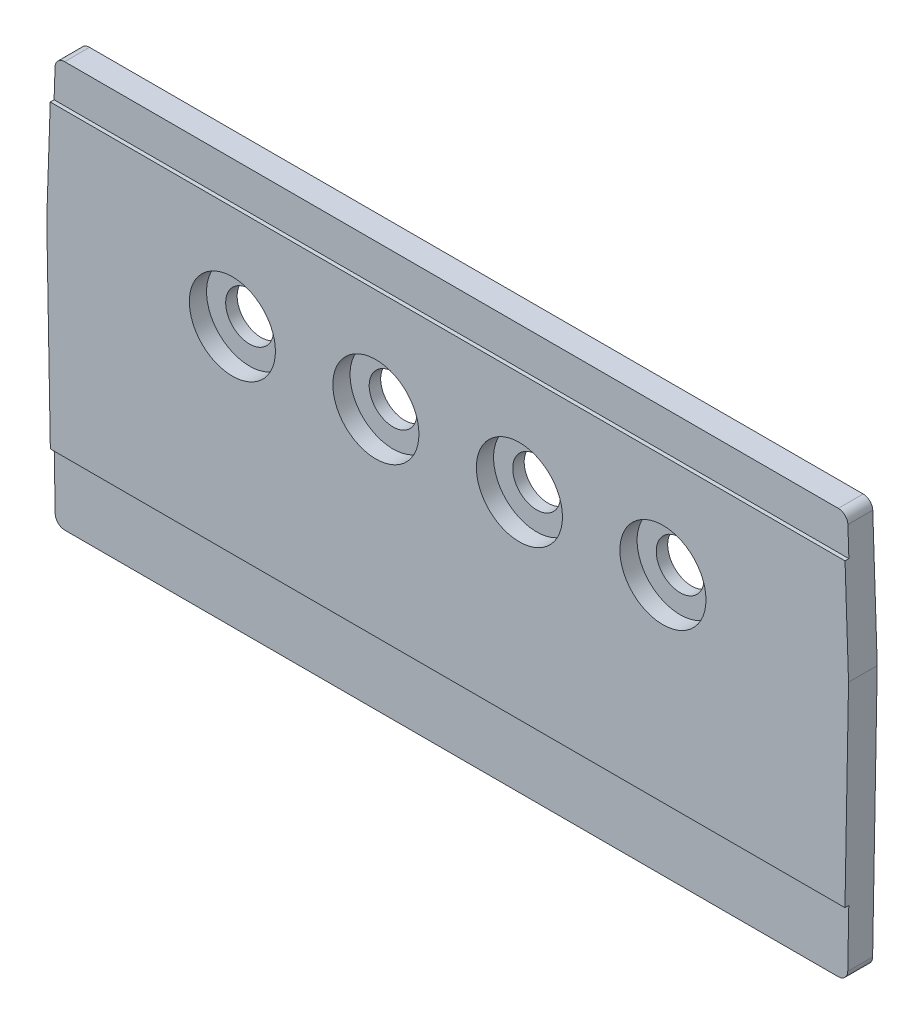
SolidWorks part; units mm, degrees
ref_plane "Plan de face" through (0, 0, 0) normal (0, 0, 1) x (1, 0, 0)
ref_plane "Plan de dessus" through (0, 0, 0) normal (0, 1, 0) x (1, 0, 0)
ref_plane "Plan de droite" through (0, 0, 0) normal (1, 0, 0) x (0, 0, -1)
sketch "Esquisse1" plane through (0, 0, 0) normal (0, 0, 1) x (1, 0, 0)
  line L0 (0, -14.2402) -> (0, 52.3672) construction
  line L1 (-7.052, 0) -> (132.3643, 0) construction
  line L2 (121.7066, 27.6) -> (-7.052, 27.6) construction
  line L3 (1.482, 0) -> (82.318, 0)
  line L4 (83.3326, 41.4338) -> (83.8, 27.6)
  line L5 (1.4668, 42.4) -> (82.3332, 42.4)
  line L6 (83.8, 27.6) -> (83.3178, 0.9819)
  line L7 (19.4, 52.3672) -> (19.4, 19.2584) construction
  line L8 (80.4261, 24.5) -> (96.6476, 24.5) construction
  line L9 (83.8, -14.2402) -> (83.8, 52.3672) construction
  line L10 (132.3643, 42.4) -> (-7.052, 42.4) construction
  line L11 (41.9, -2.3598) -> (41.9, 9.227) construction
  line L12 (83.3, 46.3047) -> (83.3, -2.9391) construction
  line L13 (0, 27.6) -> (0.4822, 0.9819)
  line L14 (0.4674, 41.4338) -> (0, 27.6)
  circle A0 centre (19.4, 27.6) radius 2.5
  circle A1 centre (34.4, 27.6) radius 2.5
  circle A2 centre (49.4, 27.6) radius 2.5
  circle A3 centre (64.4, 27.6) radius 2.5
  arc A4 (83.3178, 0.9819) -> (82.318, 0) centre (82.318, 1) cw
  arc A5 (83.3326, 41.4338) -> (82.3332, 42.4) centre (82.3332, 41.4) ccw
  arc A6 (0.4822, 0.9819) -> (1.482, 0) centre (1.482, 1) ccw
  arc A7 (0.4674, 41.4338) -> (1.4668, 42.4) centre (1.4668, 41.4) cw
  circle A8 centre (124.4, 27.6) radius 2.5
  circle A9 centre (109.4, 27.6) radius 2.5
  circle A10 centre (94.4, 27.6) radius 2.5
  circle A11 centre (79.4, 27.6) radius 2.5
  dimension "D4" = 8
  dimension "D6" = 24.5
  dimension "D9" = 1
  dimension "D1" = 19.4
  dimension "D2" = 83.8
  dimension "D3" = 27.6
  dimension "D5" = 42.4
  dimension "D7" = 0.5
  dimension "D8" = 41.9
extrude "Boss.-Extru.1" add sketch "Esquisse1" along normal blind 3
sketch "Esquisse2" plane through (0, 0, 3) normal (0, 0, 1) x (1, 0, 0)
  circle A0 centre (19.4, 27.6) radius 4.5
  circle A1 centre (34.4, 27.6) radius 4.5
  circle A2 centre (49.4, 27.6) radius 4.5
  circle A3 centre (64.4, 27.6) radius 4.5
extrude "Enlèv. mat.-Extru.1" cut sketch "Esquisse2" against normal blind 1.8
sketch "Esquisse3" plane through (0, 0, 3) normal (0, 0, 1) x (1, 0, 0)
  line L0 (88.5694, 0) -> (-3.6165, 0) construction
  line L1 (88.5694, 42.4) -> (-3.6165, 42.4) construction
  line L2 (88.5694, 38.4) -> (-3.6165, 38.4) construction
  line L3 (88.5694, 7) -> (-3.6165, 7) construction
  line L5 (-0.6304, 42.4) -> (84.7411, 42.4)
  line L6 (-0.6304, 42.4) -> (-0.6304, 38.4)
  line L7 (-0.6304, 38.4) -> (84.7411, 38.4)
  line L8 (84.7411, 42.4) -> (84.7411, 38.4)
  line L9 (-0.6304, 7) -> (84.7411, 7)
  line L10 (-0.6304, 7) -> (-0.6304, 0)
  line L11 (-0.6304, 0) -> (84.7411, 0)
  line L12 (84.7411, 7) -> (84.7411, 0)
  dimension "D1" = 4
  dimension "D2" = 7
extrude "Enlèv. mat.-Extru.2" cut sketch "Esquisse3" against normal blind 0.4
